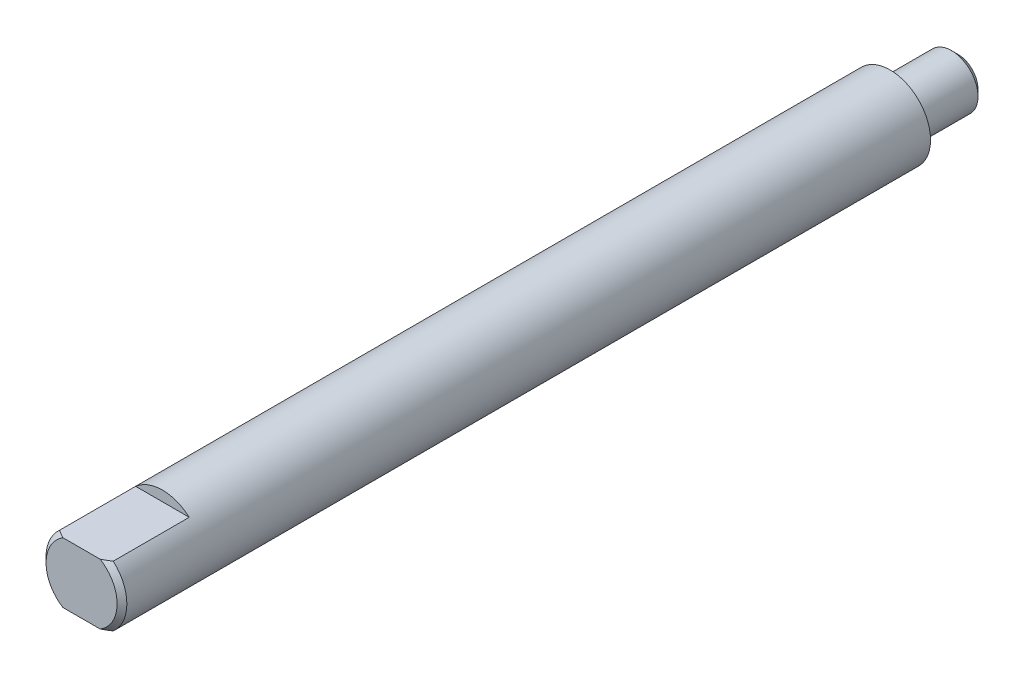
SolidWorks part; units mm, degrees
ref_plane "Front" through (0, 0, 0) normal (0, 0, 1) x (1, 0, 0)
ref_plane "Top" through (0, 0, 0) normal (0, 1, 0) x (1, 0, 0)
ref_plane "Right" through (0, 0, 0) normal (1, 0, 0) x (0, 0, -1)
sketch "Sketch1" plane through (0, 0, 0) normal (1, 0, 0) x (0, 0, -1)
  line L0 (64.766, 1.5728) -> (64.256, 2.0828)
  line L1 (-4.064, 0) -> (64.766, 0)
  line L2 (-4.064, 0) -> (-4.064, 2.79)
  line L3 (-3.684, 3.175) -> (59.436, 3.175)
  line L4 (59.436, 2.0828) -> (59.436, 3.175)
  line L5 (153.7168, 0) -> (50153.7168, 0) construction
  line L6 (-4.064, 2.79) -> (-3.684, 3.175)
  line L7 (59.436, 2.0828) -> (64.256, 2.0828)
  line L8 (64.766, 0) -> (64.766, 1.5728)
  point P2 (0, 0)
  point P12 (-13.6682, 9.8711)
  dimension "D1" = 63.5
  dimension "D2" = 5.33
  dimension "D3" = 6.35
  dimension "D4" = 4.1656
  dimension "D5" = 45
  dimension "D6" = 0.51
  dimension "D7" = 2.79
  dimension "D8" = 0.38
  dimension "D9" = 4.064
revolve "Revolve1" add sketch "Sketch1" angle 360 about L1
sketch "Sketch2" plane through (0, 0, 0) normal (1, 0, 0) x (0, 0, -1)
  line L0 (-4.064, 2.79) -> (-4.064, -2.79) construction
  line L1 (-4.064, 2.375) -> (2.286, 2.375)
  line L2 (-4.064, 2.375) -> (-4.064, 3.175)
  line L3 (-4.064, 3.175) -> (2.286, 3.175)
  line L4 (2.286, 2.375) -> (2.286, 3.175)
  line L5 (59.436, 3.175) -> (-3.684, 3.175) construction
  line L6 (-4.064, 0) -> (6.0404, 0) construction
  line L7 (2.286, -2.375) -> (2.286, -3.175)
  line L8 (-4.064, -3.175) -> (2.286, -3.175)
  line L9 (-4.064, -2.375) -> (-4.064, -3.175)
  line L10 (-4.064, -2.375) -> (2.286, -2.375)
  dimension "D1" = 0.8
  dimension "D2" = 6.35
extrude "Cut-Extrude1" cut sketch "Sketch2" against normal mid plane 10
